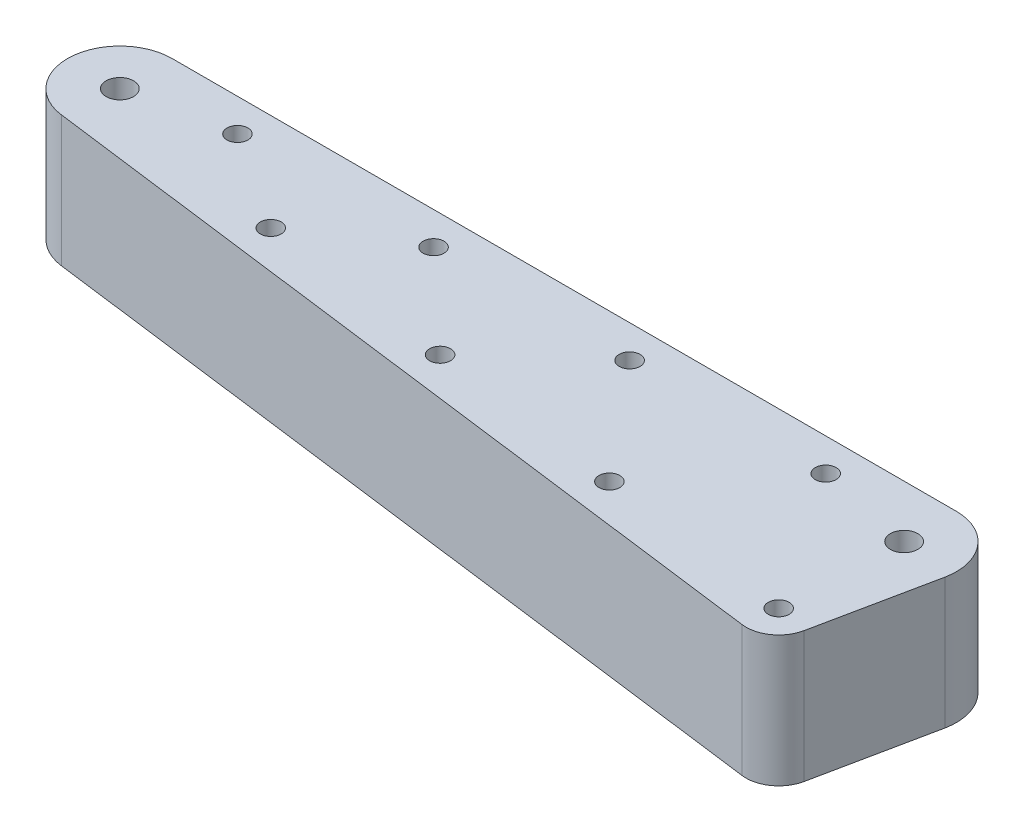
SolidWorks part; units mm, degrees
ref_plane "前视基准面" through (0, 0, 0) normal (0, 0, 1) x (1, 0, 0)
ref_plane "上视基准面" through (0, 0, 0) normal (0, 1, 0) x (1, 0, 0)
ref_plane "右视基准面" through (0, 0, 0) normal (1, 0, 0) x (0, 0, -1)
other "Configuration Table"
sketch "草图1" plane through (0, 0, 0) normal (0, 1, 0) x (1, 0, 0)
  line L0 (153.6149, -27.9339) -> (-1.0261, -7.9339)
  line L3 (0, 8) -> (120, 8)
  line L4 (124, 6.9282) -> (158.641, -13.0718)
  circle A2 centre (0, 0) radius 2.1
  circle A3 centre (154.641, -20) radius 1.6
  circle A4 centre (120, 0) radius 2.1
  arc A5 (-1.0261, -7.9339) -> (0, 8) centre (0, 0) cw
  arc A6 (120, 8) -> (124, 6.9282) centre (120, 0) cw
  arc A7 (158.641, -13.0718) -> (153.6149, -27.9339) centre (154.641, -20) cw
  dimension "D3" = 4.2
  dimension "D4" = 8
  dimension "D5" = 8
  dimension "D6" = 8
  dimension "D7" = 150
  dimension "D8" = 3.2
  dimension "D1" = 120
  dimension "D2" = 40
extrude "凸台-拉伸1" add sketch "草图1" along normal blind 4
sketch "草图2" plane through (0, 4, 0) normal (0, 1, 0) x (1, 0, 0)
  line L0 (15, 3) -> (45, 3) construction
  line L1 (30, -6.9049) -> (59.7522, -10.7528) construction
  line L3 (120, 8) -> (0, 8) construction
  line L4 (-1.0261, -7.9339) -> (153.6149, -27.9339) construction
  circle A0 centre (15, 3) radius 1.6
  circle A1 centre (45, 3) radius 1.6
  circle A2 centre (75, 3) radius 1.6
  circle A3 centre (105, 3) radius 1.6
  circle A9 centre (30, -6.9049) radius 1.6
  circle A10 centre (59.7522, -10.7528) radius 1.6
  circle A11 centre (89.5044, -14.6008) radius 1.6
  circle A12 centre (119.2566, -18.4487) radius 1.6
  point P23 (30, 3)
  dimension "D4" = 4
  dimension "D5" = 5
  dimension "D8" = 3.2
  dimension "D1" = 30
  dimension "D2" = 30
  dimension "D3" = 15
  dimension "D6" = 5
  dimension "D7" = 4
extrude "切除-拉伸1" cut sketch "草图2" against normal through all
sketch "草图3" plane through (0, 4, 0) normal (0, 1, 0) x (1, 0, 0)
  line L0 (-1.0261, -7.9339) -> (153.6149, -27.9339) construction
  line L1 (-1.0261, -7.9339) -> (118.6153, -23.4074)
  line L2 (124.1535, -19.459) -> (127.835, -1.6166)
  line L3 (0, 8) -> (120, 8)
  line L4 (15, 3) -> (45, 3) construction
  line L5 (30, -6.9049) -> (59.7522, -10.7528) construction
  arc A0 (118.6153, -23.4074) -> (124.1535, -19.459) centre (119.2566, -18.4487) ccw
  arc A1 (-1.0261, -7.9339) -> (0, 8) centre (0, 0) cw
  arc A2 (0, 8) -> (-1.0261, -7.9339) centre (0, 0) ccw construction
  arc A3 (120, 8) -> (127.835, -1.6166) centre (120, 0) cw
  circle A4 centre (0, 0) radius 2.1
  circle A5 centre (120, 0) radius 2.1
  circle A7 centre (15, 3) radius 1.6
  circle A8 centre (30, -6.9049) radius 1.6
  circle A9 centre (45, 3) radius 1.6
  circle A10 centre (75, 3) radius 1.6
  circle A11 centre (105, 3) radius 1.6
  circle A12 centre (59.7522, -10.7528) radius 1.6
  circle A13 centre (89.5044, -14.6008) radius 1.6
  circle A14 centre (119.2566, -18.4487) radius 1.6
  dimension "D1" = 4.2
  dimension "D2" = 3.2
  dimension "D4" = 30
  dimension "D3" = 30
extrude "凸台-拉伸2" add sketch "草图3" along normal blind 20
sketch "草图4" plane through (0, 0, 0) normal (0, -1, 0) x (1, 0, 0)
  line L1 (-172.5, -40) -> (172.5, -40)
  line L2 (-172.5, -40) -> (-172.5, 40)
  line L3 (-172.5, 40) -> (172.5, 40)
  line L4 (172.5, -40) -> (172.5, 40)
  line L5 (-172.5, -40) -> (172.5, 40) construction
  line L6 (-172.5, 40) -> (172.5, -40) construction
  point P0 (0, 0)
  dimension "D1" = 80
  dimension "D2" = 345
extrude "切除-拉伸2" cut sketch "草图4" against normal blind 4
sketch "草图5" plane through (0, 0, -8) normal (0, 0, -1) x (-1, 0, 0)
  line L0 (-100, 9) -> (-20, 9) construction
  line L1 (-120, 4) -> (0, 4) construction
  line L2 (-120, 24) -> (-120, 4) construction
  line L3 (0, 24) -> (0, 4) construction
  text T0 "xzm" font "Arial Rounded MT Bold" height 14
  point P3 (-96.3809, 7.7436)
  point P6 (-101.215, 9)
  dimension "D1" = 5
  dimension "D2" = 80
  dimension "D3" = 20
  dimension "D4" = 20
extrude "切除-拉伸3" cut sketch "草图5" against normal blind 0.5
